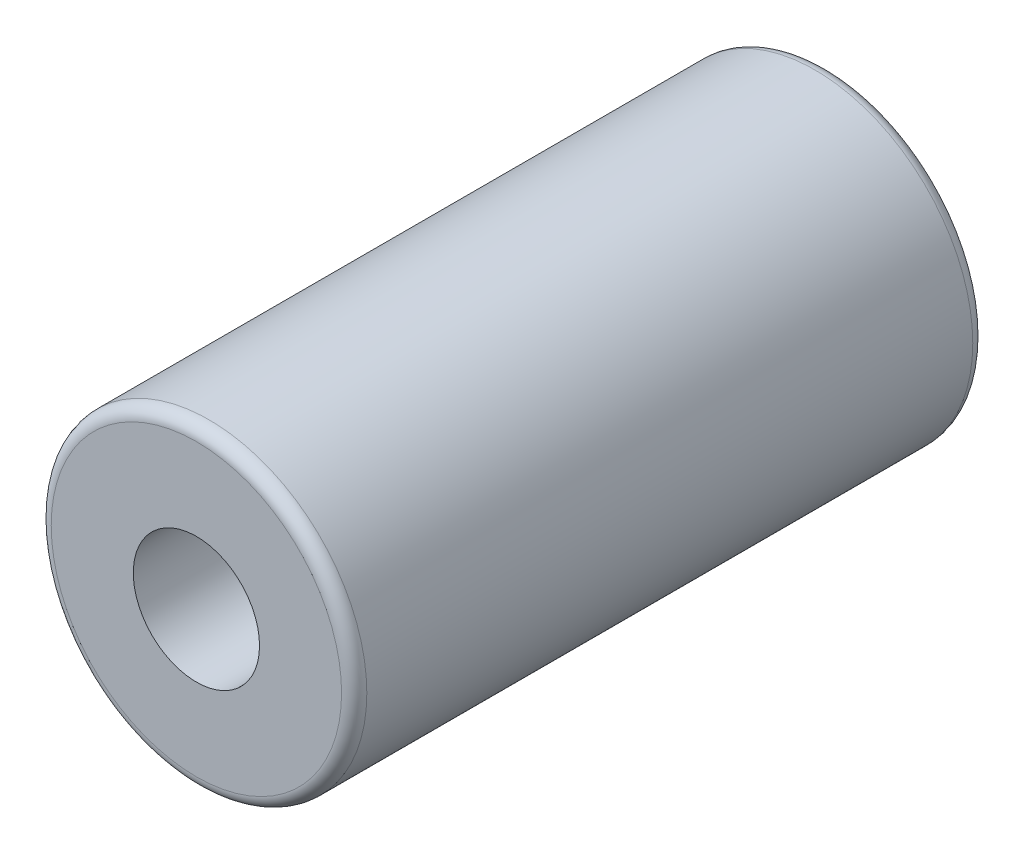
SolidWorks part; units mm, degrees
other "Camera1" [suppressed]
ref_plane "Front Plane" through (0, 0, 0) normal (0, 0, 1) x (1, 0, 0)
ref_plane "Top Plane" through (0, 0, 0) normal (0, 1, 0) x (1, 0, 0)
ref_plane "Right Plane" through (0, 0, 0) normal (1, 0, 0) x (0, 0, -1)
sketch "Sketch1" plane through (0, 0, 0) normal (0, 0, 1) x (1, 0, 0)
  circle A0 centre (0, 0) radius 12.7
  circle A1 centre (0, 0) radius 31.75
  dimension "D1" = 25.4
  dimension "D2" = 63.5
extrude "Boss-Extrude1" add sketch "Sketch1" along normal blind 127
fillet "Fillet1" radius 2.54 2 edges at (31.75, 0, 127) (31.75, 0, 0)
